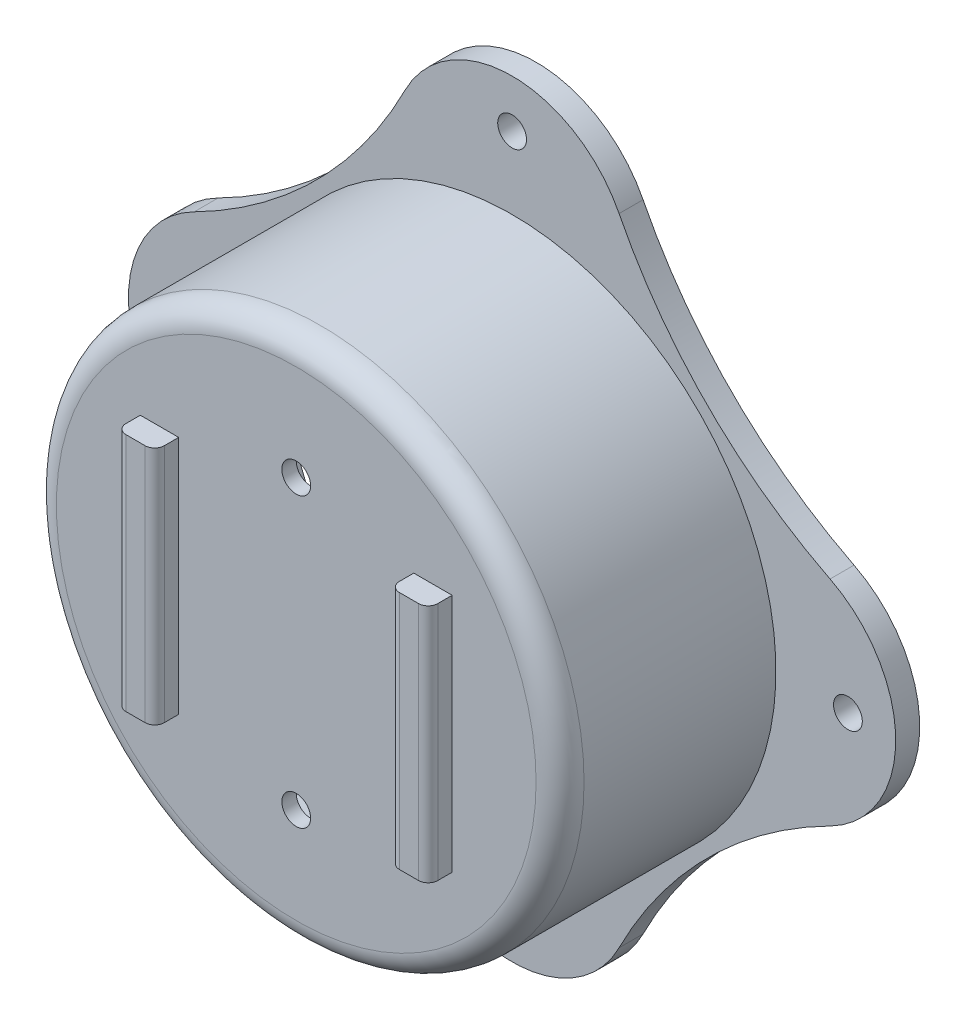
SolidWorks part; units mm, degrees
ref_plane "Ön Düzlem" through (0, 0, 0) normal (0, 0, 1) x (1, 0, 0)
ref_plane "Üst Düzlem" through (0, 0, 0) normal (0, 1, 0) x (1, 0, 0)
ref_plane "Sağ Düzlem" through (0, 0, 0) normal (1, 0, 0) x (0, 0, -1)
sketch "Çizim1" plane through (0, 0, 0) normal (0, 0, 1) x (1, 0, 0)
  circle A0 centre (0, 0) radius 55
extrude "Yükseklik-Ekstrüzyon1" add sketch "Çizim1" along normal blind 50
fillet "Radyus1" radius 5 1 edges at (55, 0, 50)
sketch "Çizim2" plane through (0, 0, 0) normal (0, 0, -1) x (-1, 0, 0)
  arc A0 (22.2978, 66.3053) -> (-22.2989, 66.3031) centre (0, 55) ccw
  circle A1 centre (0, 0) radius 55 construction
  arc A2 (66.2787, -22.2659) -> (66.2765, 22.3308) centre (54.9734, 0.0319) ccw
  arc A3 (-22.2924, -66.2468) -> (22.3042, -66.2446) centre (0.0053, -54.9415) ccw
  arc A4 (-66.2733, 22.3244) -> (-66.2712, -22.2723) centre (-54.9681, 0.0266) ccw
  arc A5 (-66.2733, 22.3244) -> (-22.2989, 66.3031) centre (-111.4943, 111.5154) ccw
  arc A6 (22.2978, 66.3053) -> (66.2765, 22.3308) centre (111.4888, 111.5262) ccw
  arc A7 (66.2787, -22.2659) -> (22.3042, -66.2446) centre (111.4997, -111.4569) ccw
  arc A8 (-22.2924, -66.2468) -> (-66.2712, -22.2723) centre (-111.4835, -111.4677) ccw
  dimension "D1" = 4
  dimension "D2" = 4
  dimension "D3" = 50
extrude "Yükseklik-Ekstrüzyon2" add sketch "Çizim2" against normal blind 5
sketch "Çizim3" plane through (0, 0, 0) normal (0, 0, -1) x (-1, 0, 0)
  circle A0 centre (0, 0) radius 52
extrude "Kes-Ekstrüzyon1" cut sketch "Çizim3" against normal blind 47
sketch "Çizim4" plane through (0, 0, 50) normal (0, 0, 1) x (1, 0, 0)
  circle A0 centre (0, 30) radius 3
  circle A1 centre (0, -30) radius 3
  dimension "D1" = 30
  dimension "D3" = 6
  dimension "D4" = 6
  dimension "D2" = 30
extrude "Kes-Ekstrüzyon2" cut sketch "Çizim4" against normal blind 47
sketch "Çizim5" plane through (0, 0, 50) normal (0, 0, 1) x (1, 0, 0)
  line L3 (24.5, 25) -> (32.5, 25)
  line L4 (24.5, 25) -> (24.5, -25)
  line L5 (24.5, -25) -> (32.5, -25)
  line L6 (32.5, 25) -> (32.5, -25)
  line L7 (-32.5, 25) -> (-32.5, -25)
  line L8 (-24.5, -25) -> (-32.5, -25)
  line L9 (-24.5, 25) -> (-24.5, -25)
  line L10 (-24.5, 25) -> (-32.5, 25)
  line L11 (-24.5, 0) -> (-24.5, 25)
  dimension "D1" = 24.5
  dimension "D2" = 24.5
extrude "Yükseklik-Ekstrüzyon3" add sketch "Çizim5" along normal blind 5 contours L9 L10 L7 L8 | L6 L3 L4 L5
fillet "Radyus2" radius 2 4 edges at (32.5, 0, 55) (24.5, 0, 55) (-24.5, 0, 55) (-32.5, 0, 55)
sketch "Çizim6" plane through (0, 0, 5) normal (0, 0, 1) x (1, 0, 0)
  circle A0 centre (70, 0) radius 3
  circle A1 centre (0, -70) radius 3
  circle A2 centre (-70, 0) radius 3
  circle A3 centre (0, 70) radius 3
  dimension "D1" = 4
extrude "Kes-Ekstrüzyon3" cut sketch "Çizim6" against normal blind 5
